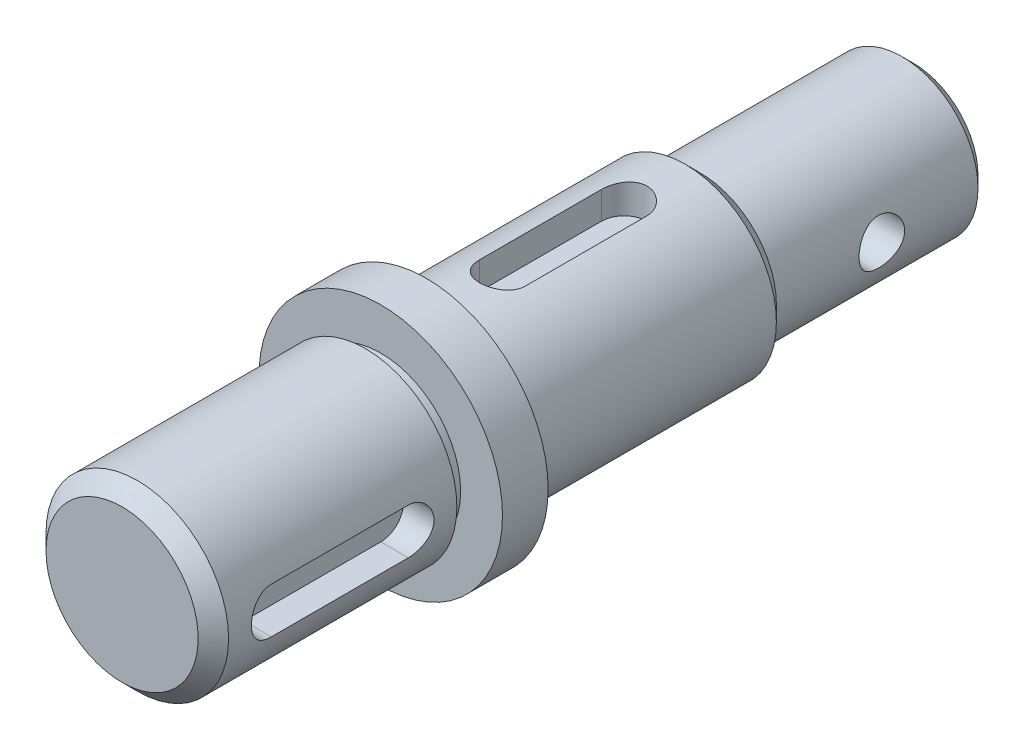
SolidWorks part; units mm, degrees
ref_plane "前视基准面" through (0, 0, 0) normal (0, 0, 1) x (1, 0, 0)
ref_plane "上视基准面" through (0, 0, 0) normal (0, 1, 0) x (1, 0, 0)
ref_plane "右视基准面" through (0, 0, 0) normal (1, 0, 0) x (0, 0, -1)
sketch "草图2" plane through (0, 0, 0) normal (1, 0, 0) x (0, 0, -1)
  line L0 (-103.7685, 0) -> (99.2708, 0) construction
  line L1 (-112.9943, 0) -> (-112.9943, 12)
  line L2 (-112.9943, 12) -> (-80.9943, 12)
  line L3 (-80.9943, 12) -> (-80.9943, 10.5)
  line L4 (-80.9943, 10.5) -> (-78.9943, 10.5)
  line L5 (-78.9943, 10.5) -> (-78.9943, 16)
  line L6 (-78.9943, 16) -> (-72.9943, 16)
  line L7 (-72.9943, 16) -> (-72.9943, 10.5)
  line L8 (-72.9943, 10.5) -> (-70.9943, 10.5)
  line L9 (-70.9943, 10.5) -> (-70.9943, 12)
  line L10 (-70.9943, 12) -> (-38.9943, 12)
  line L11 (-38.9943, 12) -> (-36.9943, 10)
  line L12 (-36.9943, 10) -> (-8.9943, 10)
  line L13 (-8.9943, 10) -> (-8.9943, 0)
  line L14 (-112.9943, 0) -> (-8.9943, 0)
  dimension "D1" = 12
  dimension "D2" = 32
  dimension "D3" = 6
  dimension "D4" = 2
  dimension "D5" = 2
  dimension "D6" = 1.5
  dimension "D7" = 1.5
  dimension "D8" = 32
  dimension "D9" = 28
  dimension "D10" = 2
  dimension "D11" = 10
  dimension "D12" = 16
  dimension "D13" = 12
revolve "旋转2" add sketch "草图2" angle 360 about L0
chamfer "倒角1" distance 1.5 angle 45 1 edges at (10, 0, 8.9943)
chamfer "倒角2" distance 2 angle 45 1 edges at (12, 0, 112.9943)
sketch "草图3" plane through (0, 0, 0) normal (1, 0, 0) x (0, 0, -1)
  circle A0 centre (-23.1264, 0) radius 3
  dimension "D1" = 6
extrude "切除-拉伸1" cut sketch "草图3" against normal mid plane 30
ref_plane "基准面1" through (12, 0, 0) normal (1, 0, 0) x (0, 0, -1)
sketch "草图4" plane through (12, 0, 0) normal (1, 0, 0) x (0, 0, -1)
  line L0 (-108.8719, 0) -> (-84.2743, 0) construction
  line L1 (-104.9943, 3) -> (-86.9943, 3)
  line L2 (-104.9943, -3) -> (-86.9943, -3)
  arc A0 (-104.9943, 3) -> (-104.9943, -3) centre (-104.9943, 0) ccw
  arc A1 (-86.9943, -3) -> (-86.9943, 3) centre (-86.9943, 0) ccw
  dimension "D1" = 6
  dimension "D2" = 6
  dimension "D3" = 6
extrude "切除-拉伸2" cut sketch "草图4" against normal blind 4
ref_plane "基准面2" through (0, 12, 0) normal (0, 1, 0) x (-1, 0, 0)
sketch "草图5" plane through (0, 12, 0) normal (0, 1, 0) x (-1, 0, 0)
  line L0 (0, 68.2892) -> (0, 51.0151) construction
  line L1 (3, 46.9943) -> (3, 62.9943)
  line L2 (-3, 62.9943) -> (-3, 46.9943)
  line L3 (0, 43.9943) -> (0, 42.3308) construction
  arc A0 (-3, 46.9943) -> (3, 46.9943) centre (0, 46.9943) ccw
  arc A1 (3, 62.9943) -> (-3, 62.9943) centre (0, 62.9943) ccw
  dimension "D1" = 6
  dimension "D2" = 6
  dimension "D3" = 8
  dimension "D4" = 8
extrude "切除-拉伸3" cut sketch "草图5" against normal blind 4
